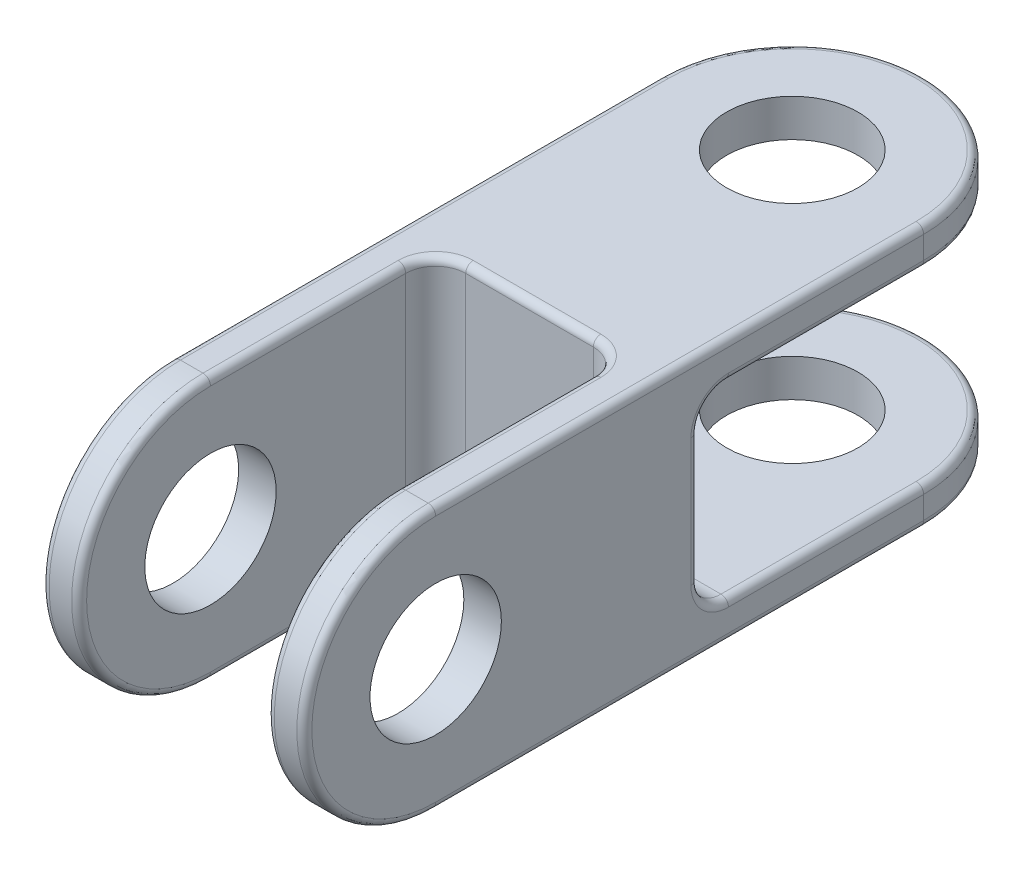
SolidWorks part; units mm, degrees
other "<Lug_&>-<Boss-Extrude1>"
other "<Lug_&>-<Boss-Extrude1>"
ref_plane "Front Plane" through (0, 0, 0) normal (0, 0, 1) x (1, 0, 0)
ref_plane "Top Plane" through (0, 0, 0) normal (0, 1, 0) x (1, 0, 0)
ref_plane "Right Plane" through (0, 0, 0) normal (1, 0, 0) x (0, 0, -1)
sketch "Sketch1" plane through (0, 0, 0) normal (0, 0, 1) x (1, 0, 0)
  line L1 (0, 0) -> (70, 0)
  line L2 (0, 0) -> (0, 70)
  line L3 (0, 70) -> (70, 70)
  line L4 (70, 0) -> (70, 70)
  dimension "D1" = 70
extrude "Boss-Extrude1" add sketch "Sketch1" along normal blind 10
inserted part "Lug_&"
move or copy body "Body-Move/Copy2" placed by mates yes
move or copy body "Body-Move/Copy3" bodies to move or copy 102 copy yes number of copies 1 translate (60, 0, 0)
inserted part "Lug_&1"
move or copy body "Body-Move/Copy5" placed by mates yes
move or copy body "Body-Move/Copy6" bodies to move or copy 104 copy yes number of copies 1 translate (0, -60, 0)
combine bodies "Combine1" operation type add bodies to combine 101 102 103 104 105
fillet "Fillet1" radius 8 4 edges at (10, 35, 10) (60, 35, 10) (35, 60, 0) (35, 10, 0)
fillet "Fillet2" radius 2 32 edges at (10, 35, 105) (10, 0, 44) (0, 35, 105) (70, 35, 105) (60, 35, 105) (60, 0, 44) (35, 70, -95) (35, 60, -95) (0, 60, -34) (35, 10, -95) (0, 10, -34) (35, 0, -95) (0, 35, 0) (70, 35, 0) (70, 60, -34) (70, 10, -34) (35, 0, 10) (35, 70, 10) (60, 70, 44) (10, 70, 44) (70, 57.6569, -2.3431) (0, 57.6569, -2.3431) (70, 12.3431, -2.3431) (0, 12.3431, -2.3431) (57.6569, 70, 12.3431) (57.6569, 0, 12.3431) (12.3431, 70, 12.3431) (12.3431, 0, 12.3431) (0, 70, 5) (70, 70, 5) (70, 0, 5) (0, 0, 5)
